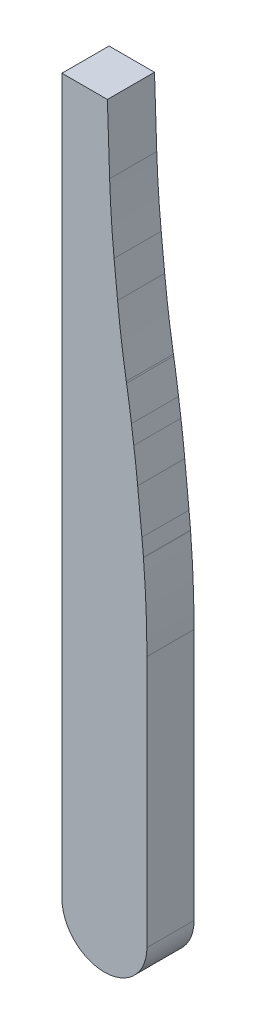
SolidWorks part; units mm, degrees
ref_plane "Front Plane" through (0, 0, 0) normal (0, 0, 1) x (1, 0, 0)
ref_plane "Top Plane" through (0, 0, 0) normal (0, 1, 0) x (1, 0, 0)
ref_plane "Right Plane" through (0, 0, 0) normal (1, 0, 0) x (0, 0, -1)
sketch "Sketch2" plane through (0, 0, 0) normal (0, 0, 1) x (1, 0, 0)
  line L3 (13.5, 224.6845) -> (-13.5, 224.6845)
  line L7 (-13.5, -200.0655) -> (-13.5, 224.6845)
  line L9 (37, -200.0655) -> (37, -25.3155)
  line L10 (15.5, 164.6845) -> (18.5, 134.6845)
  line L14 (13.5, 224.6845) -> (15.5, 164.6845)
  line L17 (18.5, 134.6845) -> (21.5, 104.6845)
  line L20 (30.5, 44.6845) -> (34.5, 4.6845)
  line L21 (34.5, 4.6845) -> (37, -25.3155)
  line L22 (21.5, 104.6845) -> (26.5, 74.6845)
  line L23 (26.5, 74.6845) -> (30.5, 44.6845)
  arc A7 (-13.5, -200.0655) -> (37, -200.0655) centre (11.75, -200.0655) ccw
  point P11 (11.75, -225.3155)
  dimension "D2" = 450
  dimension "D5" = 60
  dimension "D3" = 50.5
  dimension "D9" = 44
  dimension "D1" = 27
  dimension "D4" = 29
  dimension "D6" = 200
  dimension "D7" = 120
  dimension "D8" = 35
  dimension "D10" = 180
  dimension "D11" = 220
  dimension "D12" = 48
  dimension "D13" = 32
  dimension "D14" = 90
  dimension "D15" = 150
  dimension "D16" = 40
extrude "Boss-Extrude3" add sketch "Sketch2" along normal blind 28
fillet "Fillet3" radius 600 6 edges at (34.5, 4.6845, 14) (37, -25.3155, 14) (15.5, 164.6845, 14) (26.5, 74.6845, 14) (30.5, 44.6845, 14) (21.5, 104.6845, 14)
